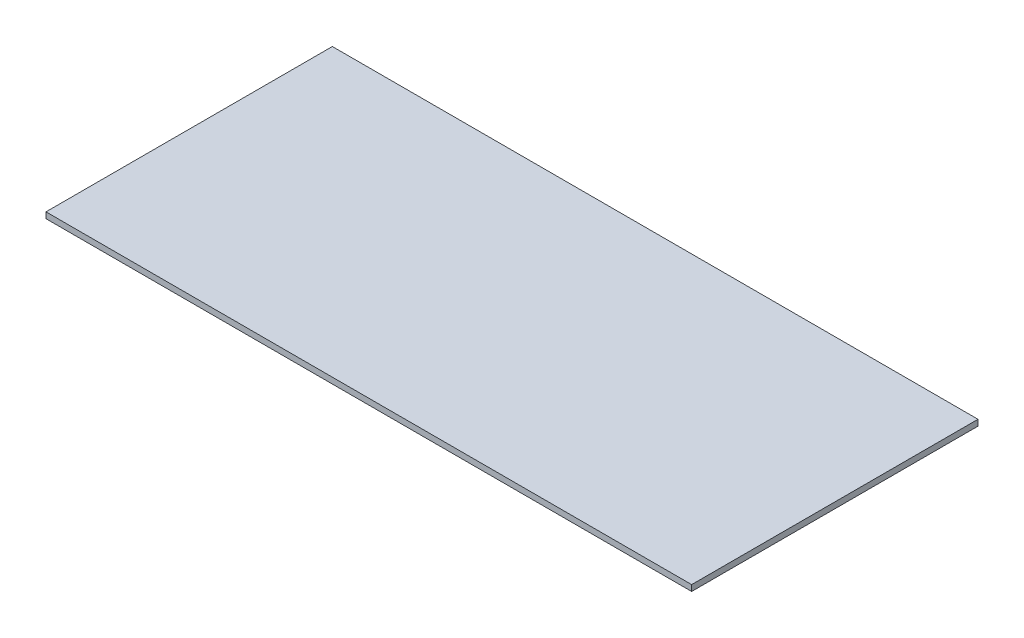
SolidWorks part; units mm, degrees
ref_plane "Front Plane" through (0, 0, 0) normal (0, 0, 1) x (1, 0, 0)
ref_plane "Top Plane" through (0, 0, 0) normal (0, 1, 0) x (1, 0, 0)
ref_plane "Right Plane" through (0, 0, 0) normal (1, 0, 0) x (0, 0, -1)
sketch "Sketch1" plane through (0, 0, 0) normal (0, 1, 0) x (1, 0, 0)
  line L1 (0, 0) -> (1371.6, 0)
  line L2 (0, 0) -> (0, 608.33)
  line L3 (0, 608.33) -> (1371.6, 608.33)
  line L4 (1371.6, 0) -> (1371.6, 608.33)
  dimension "D1" = 1371.6
  dimension "D2" = 608.33
extrude "Extrude1" add sketch "Sketch1" against normal blind 12.7
